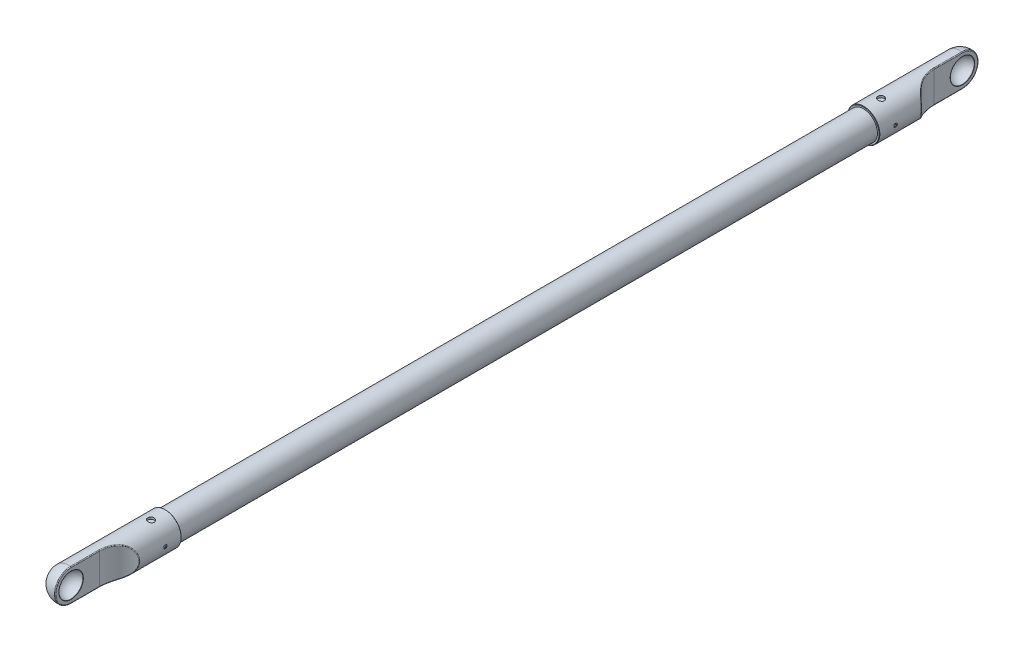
SolidWorks part; units mm, degrees
other "凸台-拉伸5"
ref_plane "前视基准面" through (0, 0, 0) normal (0, 0, 1) x (1, 0, 0)
ref_plane "上视基准面" through (0, 0, 0) normal (0, 1, 0) x (1, 0, 0)
ref_plane "右视基准面" through (0, 0, 0) normal (1, 0, 0) x (0, 0, -1)
imported_body "输入1"
sketch "草图1" plane through (0, 0, 0) normal (0, 1, 0) x (1, 0, 0)
  line L0 (-13, 71) -> (8.4587, 71) construction
  line L3 (-13, 68.4552) -> (-13, 73.5448) construction
  line L4 (2, 56) -> (2, 73.2643) construction
  line L5 (2, 86) -> (2, 68.7357) construction
  line L6 (2, 55.995) -> (2, 86.005)
  arc A1 (2, 86.005) -> (2, 55.995) centre (2, 71) ccw
  dimension "D1" = 30.01
revolve "切除-旋转4" cut sketch "草图1" angle 360 about L6
sketch "草图2" plane through (0, 0, 0) normal (0, 1, 0) x (1, 0, 0)
  line L0 (-13, -1035) -> (12.1765, -1035) construction
  line L1 (-13, -1037.5448) -> (-13, -1032.4552) construction
  line L2 (2, -1050) -> (2, -1028.637) construction
  line L3 (2, -1050.005) -> (2, -1019.995)
  arc A0 (2, -1019.995) -> (2, -1050.005) centre (2, -1035) ccw
  dimension "D1" = 30.01
revolve "切除-旋转5" cut sketch "草图2" angle 360 about L3
